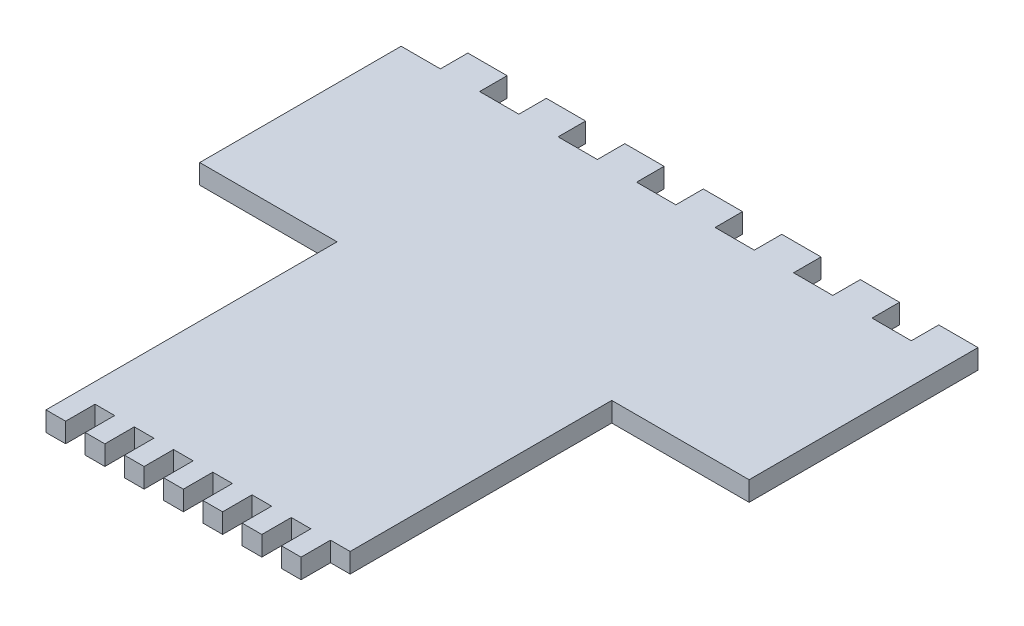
SolidWorks part; units mm, degrees
ref_plane "Front Plane" through (0, 0, 0) normal (0, 0, 1) x (1, 0, 0)
ref_plane "Top Plane" through (0, 0, 0) normal (0, 1, 0) x (1, 0, 0)
ref_plane "Right Plane" through (0, 0, 0) normal (1, 0, 0) x (0, 0, -1)
sketch "Sketch1" plane through (0, 0, 0) normal (0, 1, 0) x (1, 0, 0)
  line L1 (0, 0) -> (355.6, 0)
  line L2 (0, 0) -> (0, -148.1582)
  line L3 (0, -148.1582) -> (355.6, -148.1582)
  line L4 (355.6, 0) -> (355.6, -148.1582)
  line L5 (88.9, -148.1582) -> (266.7, -148.1582)
  line L6 (88.9, -148.1582) -> (88.9, -317.5)
  line L7 (88.9, -317.5) -> (266.7, -317.5)
  line L8 (266.7, -148.1582) -> (266.7, -317.5)
  dimension "D1" = 355.6
  dimension "D2" = 148.1582
  dimension "D3" = 88.9
  dimension "D4" = 88.9
  dimension "D5" = 169.3418
extrude "Boss-Extrude1" add sketch "Sketch1" against normal blind 12.7 contours L8 L3 L6 L7 | L4 L1 L2 L3
sketch "Sketch2" plane through (0, 0, 317.5) normal (0, 0, 1) x (1, 0, 0)
  line L0 (88.9, 0) -> (88.9, -12.7)
  line L1 (266.7, 0) -> (266.7, -12.7)
  line L2 (114.3, 0) -> (114.3, -12.7)
  line L3 (139.7, 0) -> (139.7, -12.7)
  line L4 (165.1, 0) -> (165.1, -12.7)
  line L5 (241.3, 0) -> (241.3, -12.7)
  line L6 (215.9, 0) -> (215.9, -12.7)
  line L7 (190.5, 0) -> (190.5, -12.7)
  line L8 (101.6, 0) -> (101.6, -12.7)
  line L9 (152.4, 0) -> (152.4, -12.7)
  line L10 (203.2, 0) -> (203.2, -12.7)
  line L11 (228.6, 0) -> (228.6, -12.7)
  line L12 (127, 0) -> (127, -12.7)
  line L13 (177.8, 0) -> (177.8, -12.7)
  line L14 (228.6, 0) -> (228.6, -12.7)
  line L15 (254, 0) -> (254, -12.7)
  line L16 (88.9, 0) -> (266.7, 0)
  line L17 (266.7, -12.7) -> (88.9, -12.7)
  line L18 (88.9, -12.7) -> (101.7622, -12.6881)
  dimension "D1" = 25.4
  dimension "D2" = 25.4
  dimension "D3" = 25.4
  dimension "D4" = 25.4
  dimension "D5" = 25.4
  dimension "D6" = 25.4
  dimension "D7" = 12.7
  dimension "D8" = 12.7
extrude "Boss-Extrude2" add sketch "Sketch2" along normal blind 19.05
sketch "Sketch5" plane through (0, 0, 336.55) normal (0, 0, 1) x (1, 0, 0)
  line L0 (215.9, -12.7) -> (215.9, 0)
  line L1 (266.7, -12.7) -> (215.9, -12.7)
  line L2 (266.7, -12.7) -> (266.7, 0)
  line L3 (266.7, 0) -> (215.9, 0)
  line L4 (215.9, -12.7) -> (215.9, 0)
  line L5 (215.9, -12.7) -> (215.9, 0)
  line L6 (215.9, -12.7) -> (215.9, 0)
  dimension "D1" = 4
extrude "Cut-Extrude1" cut sketch "Sketch5" against normal up to surface (19.05 mm away) contours L5 L3 L0 M3
sketch "Sketch6" plane through (0, 0, 317.5) normal (0, 0, 1) x (1, 0, 0)
  line L0 (203.2, 0) -> (241.3, 0) construction
  line L1 (215.9, 0) -> (228.6, 0)
  line L2 (215.9, 0) -> (215.9, -12.7)
  line L3 (215.9, -12.7) -> (228.6, -12.7)
  line L4 (228.6, 0) -> (228.6, -12.7)
  line L5 (203.2, -12.7) -> (241.3, -12.7) construction
  line L6 (241.3, 0) -> (241.3, -12.7) construction
  line L7 (203.2, 0) -> (203.2, -12.7) construction
  dimension "D1" = 12.7
  dimension "D2" = 12.7
extrude "Boss-Extrude3" add sketch "Sketch6" along normal up to surface (19.05 mm away)
sketch "Sketch7" plane through (0, 0, 0) normal (0, 1, 0) x (1, 0, 0)
  line L0 (0, -17.78) -> (355.6, -17.78)
  line L1 (0, 0) -> (0, -148.1582) construction
  line L2 (355.6, 0) -> (355.6, -148.1582) construction
  line L3 (0, 0) -> (355.6, 0) construction
  line L4 (0, -17.78) -> (0, 0)
  line L5 (25.4, -17.78) -> (25.4, 0)
  line L6 (50.8, -17.78) -> (50.8, 0)
  line L7 (76.2, -17.78) -> (76.2, 0)
  line L8 (101.6, -17.78) -> (101.6, 0)
  line L9 (127, -17.78) -> (127, 0)
  line L10 (152.4, -17.78) -> (152.4, 0)
  line L11 (177.8, -17.78) -> (177.8, 0)
  line L12 (203.2, -17.78) -> (203.2, 0)
  line L13 (228.6, -17.78) -> (228.6, 0)
  line L14 (254, -17.78) -> (254, 0)
  line L15 (279.4, -17.78) -> (279.4, 0)
  line L16 (304.8, -17.78) -> (304.8, 0)
  line L17 (330.2, -17.78) -> (330.2, 0)
  line L18 (0, 0) -> (355.6, 0)
  line L19 (355.6, 0) -> (355.6, -17.78)
  dimension "D1" = 17.78
  dimension "D2" = 14
extrude "Cut-Extrude2" cut sketch "Sketch7" against normal blind 25.4 contours L0 L5 M13 M14 | L0 L7 L6 M13 | L0 L9 L8 M13 | L0 L11 L10 M13 | L0 L13 L12 M13 | L0 L15 L14 M13 | L0 L17 L16 M13
